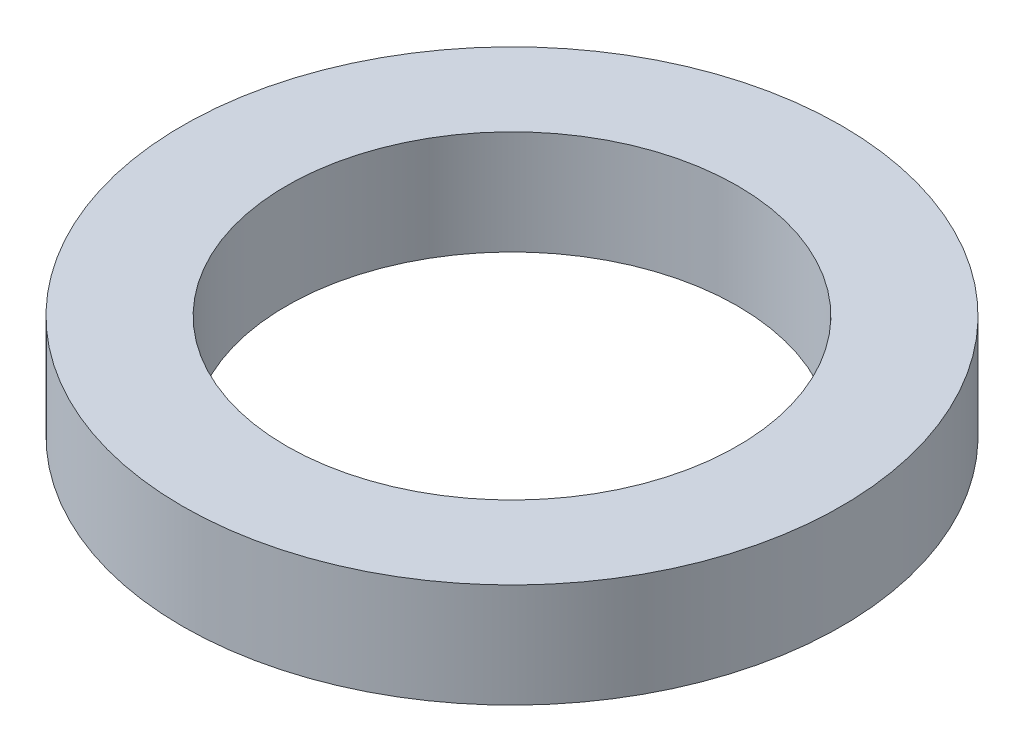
SolidWorks part; units mm, degrees
ref_plane "Front" through (0, 0, 0) normal (0, 0, 1) x (1, 0, 0)
ref_plane "Top" through (0, 0, 0) normal (0, 1, 0) x (1, 0, 0)
ref_plane "Right" through (0, 0, 0) normal (1, 0, 0) x (0, 0, -1)
sketch "Sketch1" plane through (0, 0, 0) normal (0, 0, 1) x (1, 0, 0)
  line L0 (0, 0) -> (0, 14.4219) construction
  line L1 (-1.651, 0) -> (-2.413, 0)
  line L2 (-2.413, 0) -> (-2.413, 0.762)
  line L3 (-2.413, 0.762) -> (-1.651, 0.762)
  line L4 (-1.651, 0.762) -> (-1.651, 0)
  dimension "D1" = 3.302
  dimension "D2" = 0.762
  dimension "D3" = 4.826
revolve "Revolve1" add sketch "Sketch1" angle 360 about L0
